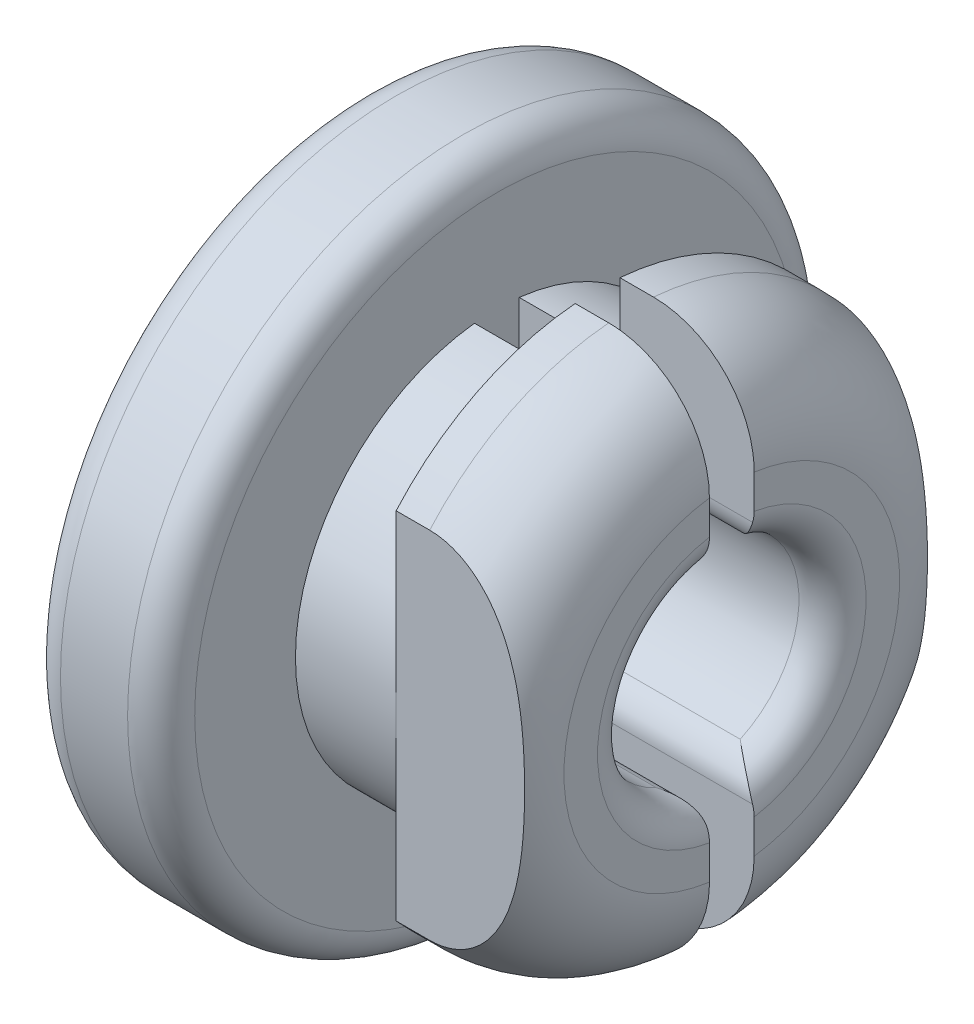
SolidWorks part; units mm, degrees
ref_plane "Face" through (0, 0, 0) normal (0, 0, 1) x (1, 0, 0)
ref_plane "Dessus" through (0, 0, 0) normal (0, 1, 0) x (1, 0, 0)
ref_plane "Droite" through (0, 0, 0) normal (1, 0, 0) x (0, 0, -1)
sketch "Esquisse1" plane through (0, 0, 0) normal (0, 0, 1) x (1, 0, 0)
  line L0 (0, 0) -> (43.9148, 0) construction
  line L1 (11, 3) -> (0, 3)
  line L2 (0, 3) -> (0, 10)
  line L3 (0, 10) -> (4, 10)
  line L4 (4, 10) -> (4, 6)
  line L5 (4, 6) -> (7, 6)
  line L6 (7, 6) -> (7, 8)
  line L7 (7, 8) -> (8, 8)
  line L8 (11, 5) -> (11, 3)
  arc A0 (8, 8) -> (11, 5) centre (8, 5) cw
  point P13 (11, 8)
  dimension "D8" = 3
  dimension "D1" = 6
  dimension "D2" = 10
  dimension "D3" = 4
  dimension "D4" = 3
  dimension "D5" = 12
  dimension "D6" = 16
  dimension "D7" = 4
revolve "Révolution1" add sketch "Esquisse1" angle 360 about L0
sketch "Esquisse2" plane through (11, 0, 0) normal (1, 0, 0) x (0, 0, -1)
  line L0 (0, 0) -> (0, 10.859) construction
  line L1 (0.6663, 11.4098) -> (0.6663, -12.6753)
  line L2 (-0.6663, 11.4098) -> (-0.6663, -12.6753)
  line L3 (6, 6.0688) -> (6, -12.5971)
  line L4 (-6, 6.0688) -> (-6, -12.5971)
  line L5 (6, -12.5971) -> (13.2753, -12.5971)
  line L6 (-6, -12.5971) -> (-13.2753, -12.5971)
  line L7 (13.2753, -12.5971) -> (13.2753, 6.0688)
  line L8 (-13.2753, -12.5971) -> (-13.2753, 6.0688)
  line L9 (13.2753, 6.0688) -> (6, 6.0688)
  line L10 (-13.2753, 6.0688) -> (-6, 6.0688)
  line L11 (0.6663, -12.6753) -> (-0.6663, -12.6753)
  line L12 (0.6663, 11.4098) -> (-0.6663, 11.4098)
  point P16 (0, -12.6753)
  point P17 (0, 11.4098)
  dimension "D1" = 12
extrude "Enlèv. mat.-Extru.1" cut sketch "Esquisse2" against normal up to surface (7 mm away)
fillet "Congé1" radius 1
